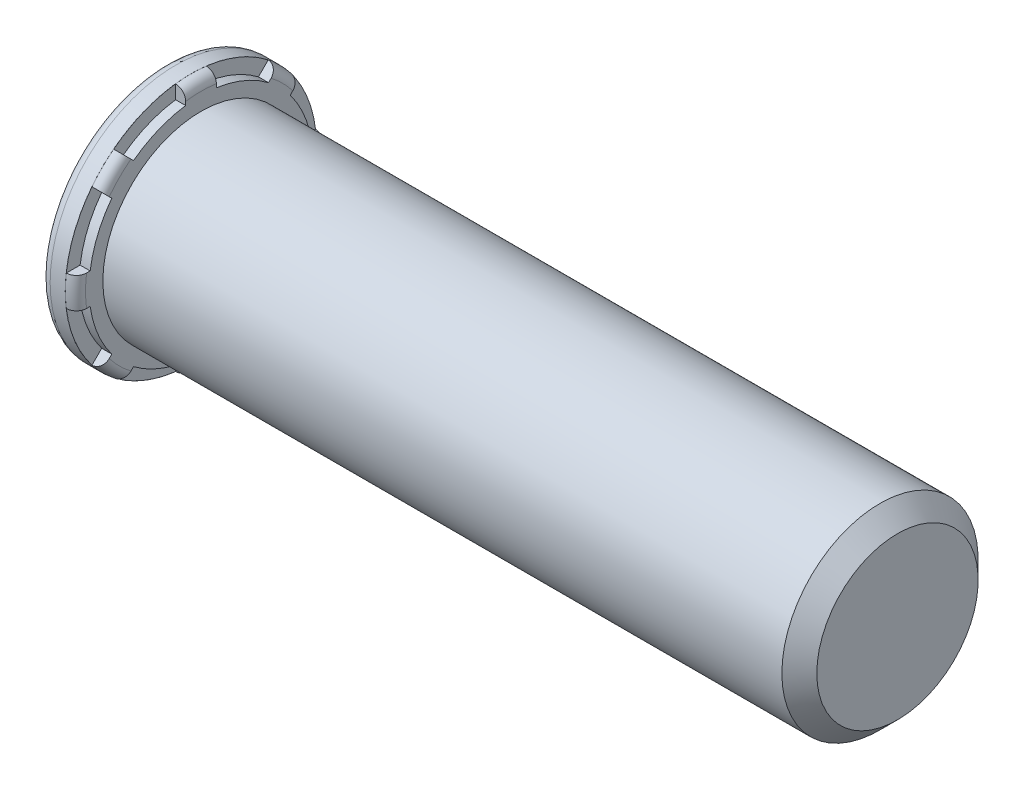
SolidWorks part; units mm, degrees
revolve "BaseBody" add sketch "BodySke" angle 360 about L6
sketch "BodySke" plane through (0, 0, 0) normal (0, 0, 1) x (1, 0, 0)
  line L0 (-0.64, 2.944) -> (-0.64, 0)
  line L1 (0.2585, 2.9415) -> (0.2585, 2.5)
  line L3 (0.2585, 2.5) -> (17.555, 2.5)
  line L4 (18, 2.055) -> (18, 0)
  line L5 (18, 0) -> (-0.64, 0)
  line L6 (0, 0) -> (50.554, 0) construction
  line L8 (18, 2.055) -> (17.555, 2.5)
  line L9 (-0.384, 3.2) -> (0, 3.2)
  line L10 (0.0025, 3.1975) -> (0, 3.1975)
  line L11 (0.8, 19.05) -> (0.8, -3.175) construction
  line L12 (0, 3.1975) -> (0, 3.2)
  arc A0 (-0.64, 2.944) -> (-0.384, 3.2) centre (-0.384, 2.944) cw
  arc A1 (0.0025, 3.1975) -> (0.2585, 2.9415) centre (0.0025, 2.9415) cw
ref_plane "Plane1" through (0, 0, 0) normal (0, 0, 1) x (1, 0, 0)
ref_plane "Plane2" through (0, 0, 0) normal (0, 1, 0) x (1, 0, 0)
ref_plane "Plane3" through (0, 0, 0) normal (1, 0, 0) x (0, 0, -1)
other "Configuration Table"
sketch "ThdSchSke" plane through (0, 0, 0) normal (0, 0, 1) x (1, 0, 0)
  line L0 (2.3, -2.055) -> (1.9884, -2.5)
  line L1 (2.3, -2.055) -> (2.6116, -2.5)
  line L2 (2.6116, -2.5) -> (2.6116, -3.125)
  line L3 (-3.175, 0) -> (5.1513, 0) construction
  line L4 (0, -3.2) -> (0, 3.2) construction
  line L5 (2.6116, -3.125) -> (1.9884, -3.125)
  line L6 (1.9884, -3.125) -> (1.9884, -2.5)
revolve "ThreadSchematic" [suppressed] cut sketch "ThdSchSke" angle 360 about L3
pattern_linear "ThdSchPat" [suppressed]
sketch "RibCutSke" plane through (0.2585, 1.7944, -0.091) normal (1, 0, 0) x (0, 0, -1)
  line L0 (0.3001, 1.0286) -> (0.3001, 1.3816)
  line L1 (1.6287, 0.4783) -> (1.8783, 0.7279)
  line L2 (0.3001, 0.6748) -> (0.3001, 2.4006) construction
  line L3 (-0.091, -1.7944) -> (-0.091, 5.0239) construction
  line L4 (-0.091, -1.7944) -> (0.3001, 0.6748) construction
  line L5 (-0.091, -1.7944) -> (1.3785, 0.2281) construction
  line L6 (1.3785, 0.2281) -> (2.6039, 1.4535) construction
  circle A0 centre (-0.091, -1.7944) radius 2.9415 construction
  arc A1 (1.6287, 0.4783) -> (0.3001, 1.0286) centre (-0.091, -1.7944) ccw
  arc A2 (1.8783, 0.7279) -> (0.3001, 1.3816) centre (-0.091, -1.7944) ccw
  circle A4 centre (-0.091, -1.7944) radius 2.5 construction
extrude "RibCut" cut sketch "RibCutSke" against normal blind 0.2561
pattern_circular "RibCutsPat" count 8 every 45 about axis through (0, 0, 0) along (1, 0, 0) of "RibCut"
equation "' \"Length@BodySke\" = 18"
equation "' \"H_dia@BodySke\" = 6.4"
equation "' \"Start@ThdSchSke\" = 2.3"
equation "' \"T_dim@BodySke\" = 0.64"
equation "' \"Diameter@BodySke\" = 5"
equation "' \"Minor_dia@BodySke\" = 4.11"
equation "' \"Advance@BodySke\" = 0.8"
equation "\"Fillet_rad@BodySke\" =  \"T_dim@BodySke\" * 0.4"
equation "\"Num_ribs@RibCutsPat\" = 8"
equation "\"Angle@RibCutSke\" =\"Angle@RibCutsPat\""
equation "\"Rib_root_half_angle@RibCutSke\" = \"Angle@RibCutSke\" / 5"
equation "\"Rib_root_gap_angle@RibCutSke\" = \"Angle@RibCutSke\" - (2 * \"Rib_root_half_angle@RibCutSke\" )"
equation "\"Rib_root_dia@RibCutSke\" = \"Diameter@BodySke\""
equation "\"Inner_dia@RibCutSke\" = ( \"H_dia@BodySke\" + \"Diameter@BodySke\" ) / 2"
equation "\"Outer_dia@RibCutSke\" = \"H_dia@BodySke\""
equation "\"Depth@RibCut\" =  \"Fillet_rad@BodySke\" + 0.0001"
equation "\"Thread_length@ThreadCosmetic\" = \"Length@BodySke\" - \"Start@ThdSchSke\""
equation "\"Thread_minor@ThreadCosmetic\" = \"Minor_dia@BodySke\""
equation "\"Thread_minor@ThdSchSke\" = \"Minor_dia@BodySke\""
equation "\"Diameter@ThdSchSke\" = \"Diameter@BodySke\""
equation "\"Overcut@ThdSchSke\" = \"Diameter@BodySke\" * 1.25"
equation "\"Num_threads@ThdSchPat\" = int( \"Thread_length@ThreadCosmetic\" / \"Advance@BodySke\" + 0.999 )  + 1"
equation "\"Advance@ThdSchPat\" = \"Thread_length@ThreadCosmetic\" /  (\"Num_threads@ThdSchPat\" - 1) 'relax it"
equation "\"Num_threads@ThdSchPat\" = \"Num_threads@ThdSchPat\" - sgn( \"Num_threads@ThdSchPat\" - 1) '---chamfered tips only---"
